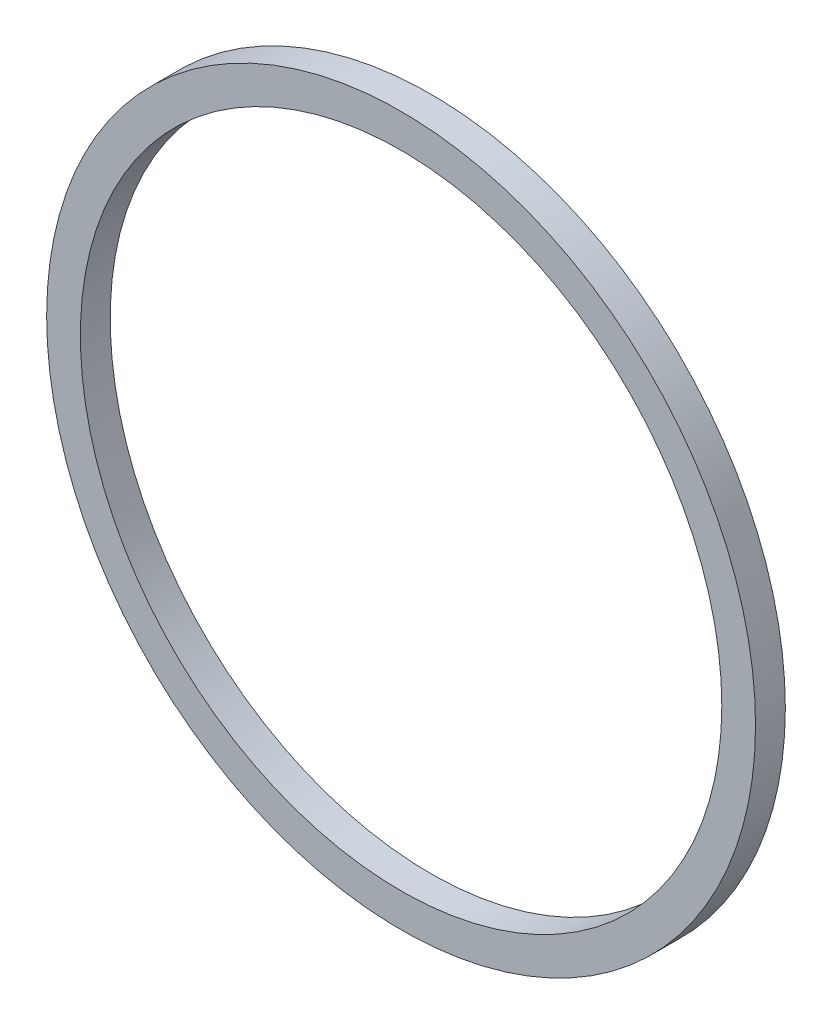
SolidWorks part; units mm, degrees
ref_plane "Plan1" through (0, 0, 0) normal (0, 0, 1) x (1, 0, 0)
ref_plane "Plan2" through (0, 0, 0) normal (0, 1, 0) x (1, 0, 0)
ref_plane "Plan3" through (0, 0, 0) normal (1, 0, 0) x (0, 0, -1)
sketch "Esquisse1" plane through (0, 0, 0) normal (0, 0, 1) x (1, 0, 0)
  circle A0 centre (0, 0) radius 11.88
  circle A1 centre (0, 0) radius 10.75
  dimension "D1" = 23.76
  dimension "D2" = 21.5
extrude "Base-Extrusion" add sketch "Esquisse1" along normal blind 1
